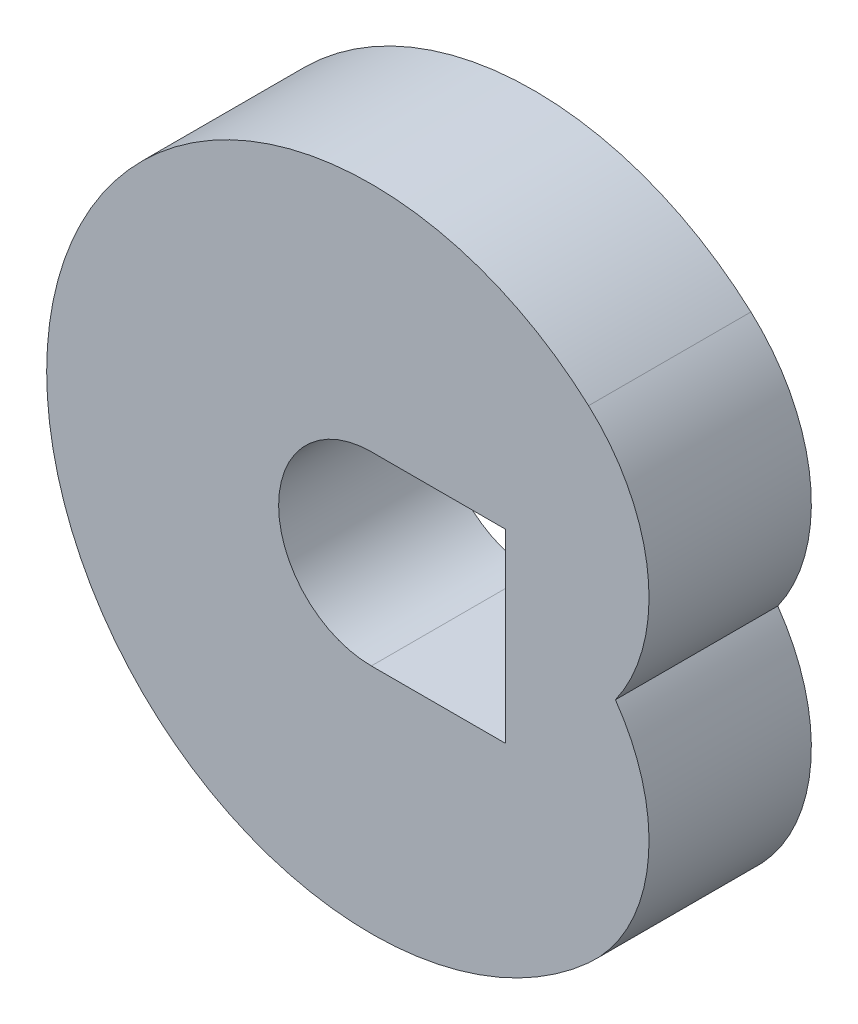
SolidWorks part; units mm, degrees
ref_plane "前视基准面" through (0, 0, 0) normal (0, 0, 1) x (1, 0, 0)
ref_plane "上视基准面" through (0, 0, 0) normal (0, 1, 0) x (1, 0, 0)
ref_plane "右视基准面" through (0, 0, 0) normal (1, 0, 0) x (0, 0, -1)
sketch "草图1" plane through (0, 0, 0) normal (0, 0, 1) x (1, 0, 0)
  line L0 (0, 0) -> (535.3045, 594.5159) construction
  line L1 (0, 0) -> (535.3045, -594.5159) construction
  line L2 (0, 0) -> (-791.161, 0) construction
  line L3 (0, 0) -> (-450, 0) construction
  line L4 (0, 228.4776) -> (330, 228.4776)
  line L5 (330, 228.4776) -> (330, -228.4776)
  line L6 (330, -228.4776) -> (0, -228.4776)
  arc A0 (535.3045, 594.5159) -> (535.3045, -594.5159) centre (0, 0) ccw
  arc A1 (535.3045, 594.5159) -> (601.4118, 0) centre (234.1957, 260.1007) cw
  arc A2 (535.3045, -594.5159) -> (601.4118, 0) centre (234.1957, -260.1007) ccw
  arc A3 (0, 228.4776) -> (0, -228.4776) centre (0, 0) ccw
  dimension "D1" = 800
  dimension "D2" = 350
  dimension "D3" = 132
  dimension "D4" = 330
extrude "凸台-拉伸1" add sketch "草图1" along normal blind 400 contours A0 A2 A1 | L4 L5 L6 A3
